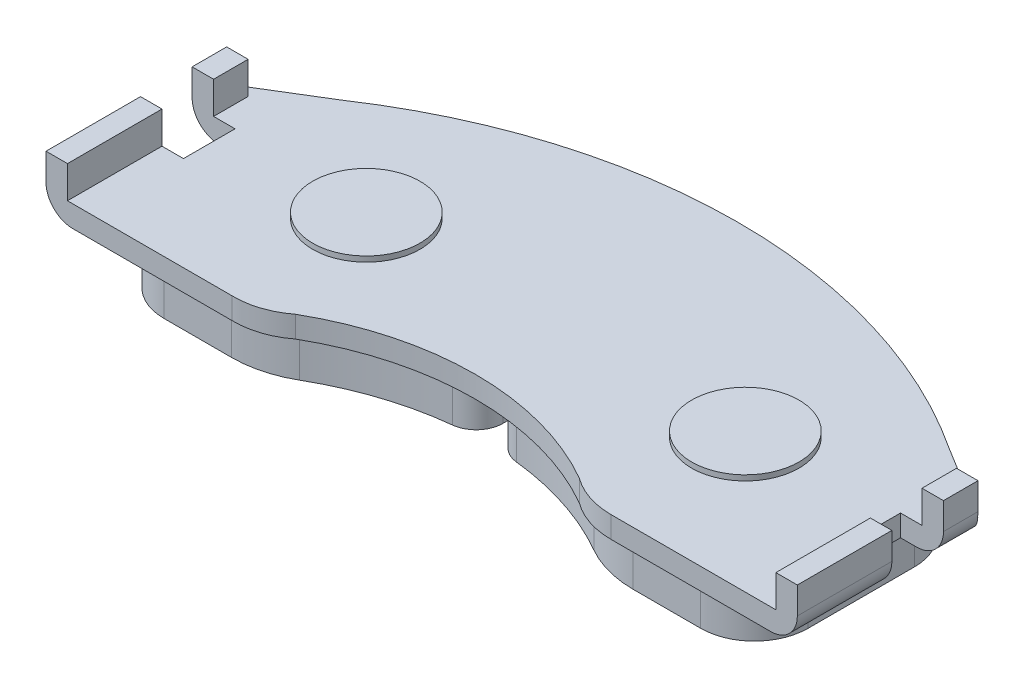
SolidWorks part; units mm, degrees
ref_plane "Front Plane" through (0, 0, 0) normal (0, 0, 1) x (1, 0, 0)
ref_plane "Top Plane" through (0, 0, 0) normal (0, 1, 0) x (1, 0, 0)
ref_plane "Right Plane" through (0, 0, 0) normal (1, 0, 0) x (0, 0, -1)
sketch "Sketch2" plane through (0, 0, 0) normal (0, 1, 0) x (1, 0, 0)
  line L0 (-60, -1.8317) -> (-60, -21.6648)
  line L1 (60, -1.8317) -> (60, -21.6648)
  line L2 (-50, -31.6648) -> (-37.4166, -31.6648)
  line L3 (50, -31.6648) -> (37.4166, -31.6648)
  arc A0 (-55.5556, 6.4831) -> (55.5556, 6.4831) centre (0, -76.6648) cw
  arc A1 (-27.4388, -28.9982) -> (27.4388, -28.9982) centre (0, -76.6648) cw
  arc A2 (-60, -21.6648) -> (-50, -31.6648) centre (-50, -21.6648) ccw
  arc A3 (60, -21.6648) -> (50, -31.6648) centre (50, -21.6648) cw
  arc A4 (60, -1.8317) -> (55.5556, 6.4831) centre (50, -1.8317) ccw
  arc A5 (-55.5556, 6.4831) -> (-60, -1.8317) centre (-50, -1.8317) ccw
  arc A6 (-37.4166, -31.6648) -> (-27.4388, -28.9982) centre (-37.4166, -11.6648) ccw
  arc A7 (37.4166, -31.6648) -> (27.4388, -28.9982) centre (37.4166, -11.6648) cw
  point P10 (-60, -31.6648)
  point P13 (60, -31.6648)
  point P18 (-60, 3.3352)
  dimension "D4" = 10
  dimension "D5" = 100
  dimension "D6" = 20
  dimension "D2" = 55
  dimension "D1" = 35
  dimension "D3" = 120
extrude "Boss-Extrude1" add sketch "Sketch2" along normal blind 8
sketch "Sketch4" plane through (0, 8, 0) normal (0, 1, 0) x (1, 0, 0)
  line L0 (-70, 0) -> (-70, -6.4371)
  line L1 (-70, -6.4371) -> (-62, -6.4371)
  line L2 (-62, -6.4371) -> (-62, -16.0505)
  line L3 (-62, -16.0505) -> (-70, -16.0505)
  line L4 (-70, -16.0505) -> (-70, -33.6648)
  line L5 (-70, -33.6648) -> (-35.3122, -33.6648)
  line L6 (-60, -1.8317) -> (-60, -21.6648) construction
  line L7 (-50, -31.6648) -> (-37.4166, -31.6648) construction
  line L8 (0, -55) -> (0, 55) construction
  line L9 (70, -33.6648) -> (35.3122, -33.6648)
  line L10 (70, -16.0505) -> (70, -33.6648)
  line L11 (62, -16.0505) -> (70, -16.0505)
  line L12 (62, -6.4371) -> (62, -16.0505)
  line L13 (70, -6.4371) -> (62, -6.4371)
  line L14 (70, 0) -> (70, -6.4371)
  line L15 (56.0762, 8.5377) -> (70, 0)
  line L16 (-56.6667, 8.1461) -> (-70, 0)
  arc A0 (-35.3122, -33.6648) -> (-26.441, -30.7315) centre (-35.0113, -19.6938) ccw
  arc A1 (26.441, -30.7315) -> (35.3122, -33.6648) centre (35.3122, -18.7839) ccw
  arc A2 (56.6667, 8.1461) -> (-56.6667, 8.1461) centre (0, -76.6648) ccw
  arc A3 (56.0762, 8.5377) -> (-56.6667, 8.1461) centre (0, -76.6648) ccw
  arc A5 (26.441, -30.7315) -> (-26.441, -30.7315) centre (0, -76.6648) ccw
  arc A6 (26.441, -30.7315) -> (-26.441, -30.7315) centre (0, -76.6648) ccw
  dimension "D1" = 10
  dimension "D2" = 2
  dimension "D3" = 2
  dimension "D4" = 2
  dimension "D5" = 2
extrude "Boss-Extrude2" add sketch "Sketch4" along normal blind 4
sketch "Sketch6" plane through (0, 0, 0) normal (0, 0, 1) x (1, 0, 0)
  line L0 (1.5, 0) -> (-1.5, 0)
  line L1 (-27.4388, 0) -> (27.4388, 0) construction
  line L2 (1.5, 0) -> (1.5, 8)
  line L3 (-27.4388, 8) -> (27.4388, 8) construction
  line L4 (1.5, 8) -> (-1.5, 8)
  line L5 (-26.441, 8) -> (26.441, 8) construction
  line L6 (-1.5, 8) -> (-1.5, 0)
  point P0 (1.5, 8)
  point P6 (0, 0)
  dimension "D1" = 3
extrude "Cut-Extrude1" cut sketch "Sketch6" against normal through all and the other way through all
fillet "Fillet2" radius 5 4 edges at (-1.5, 4, -23.3239) (1.5, 4, -23.3239) (-1.5, 4, 21.6853) (1.5, 4, 21.6853)
sketch "Sketch7" plane through (0, 12, 0) normal (0, 1, 0) x (1, 0, 0)
  line L0 (-70, -6.4371) -> (-62, -6.4371) construction
  line L1 (-70, 0) -> (-66, 0)
  line L2 (-70, 0) -> (-70, -6.4371)
  line L3 (-70, -6.4371) -> (-66, -6.4371)
  line L4 (-66, 0) -> (-66, -6.4371)
  line L5 (-70, -33.6648) -> (-35.3122, -33.6648) construction
  line L6 (-70, -16.0505) -> (-66, -16.0505)
  line L7 (-70, -16.0505) -> (-70, -33.6648)
  line L8 (-70, -33.6648) -> (-66, -33.6648)
  line L9 (-66, -16.0505) -> (-66, -33.6648)
extrude "Boss-Extrude3" add sketch "Sketch7" along normal blind 6
mirror "Mirror1" about plane through (0, 0, 0) normal (1, 0, 0) of "Boss-Extrude3"
fillet "Fillet3" radius 5 2 edges at (-70, 8, 3.2185) (-70, 8, 24.8576)
fillet "Fillet4" radius 5 2 edges at (70, 8, 3.2185) (70, 8, 24.8576)
sketch "Sketch8" plane through (0, 12, 0) normal (0, 1, 0) x (1, 0, 0)
  circle A0 centre (-35.3122, -8.6648) radius 10
  point P4 (0, 0)
  point P5 (0, 0)
  point P6 (0, 0)
  point P7 (0, 0)
  dimension "D1" = 20
  dimension "D3" = 25
extrude "Boss-Extrude5" add sketch "Sketch8" along normal blind 1
mirror "Mirror2" about plane through (0, 0, 0) normal (1, 0, 0) of "Boss-Extrude5"
sketch "Sketch3" plane through (0, 8, 0) normal (0, 1, 0) x (1, 0, 0)
  arc A5 (54.9072, 7.3146) -> (-57.3151, 7.3146) centre (-1.2039, -76.6648) ccw
  arc A6 (64.2157, 0.2849) -> (-67.1995, -0.2084) centre (-1.2039, -76.6648) ccw
  arc A8 (25.736, -29.8648) -> (-28.1439, -29.8648) centre (-1.2039, -76.6648) ccw
  arc A9 (25.736, -29.8648) -> (-28.1439, -29.8648) centre (-1.2039, -76.6648) ccw
  point P0 (-67.1995, 0)
  point P2 (-67.2163, 0)
  point P12 (64.2157, 0)
  point P14 (0, 0)
  point P18 (0, 0)
  point P19 (-68.5852, -1.4662)
  dimension "D1" = 1
  dimension "D2" = 1
